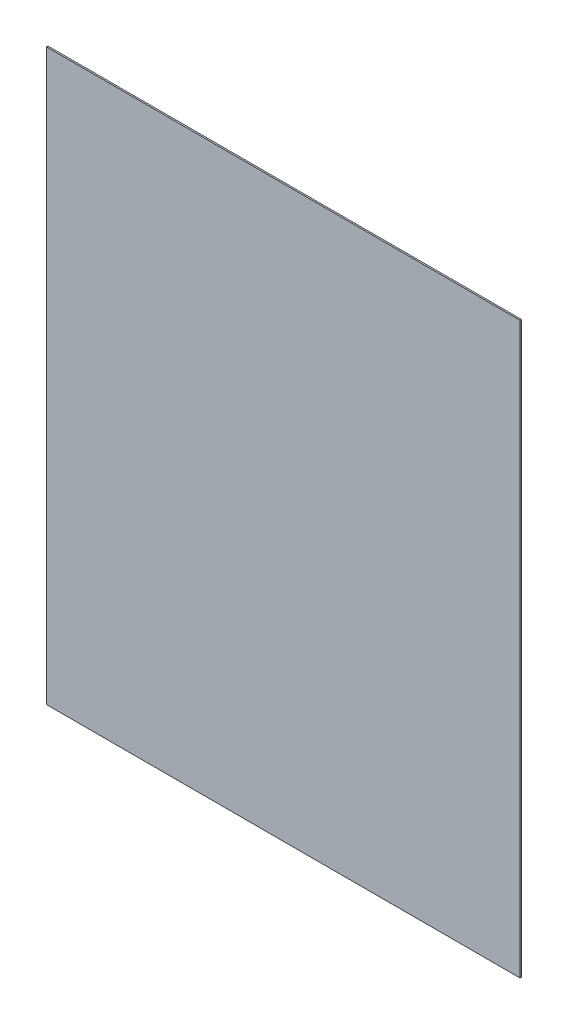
SolidWorks part; units mm, degrees
ref_plane "Plan de face" through (0, 0, 0) normal (0, 0, 1) x (1, 0, 0)
ref_plane "Plan de dessus" through (0, 0, 0) normal (0, 1, 0) x (1, 0, 0)
ref_plane "Plan de droite" through (0, 0, 0) normal (1, 0, 0) x (0, 0, -1)
sketch "Model" plane through (0, 0, 0) normal (0, 0, 1) x (1, 0, 0)
  line L0 (1032.3846, 654.3047) -> (822.3846, 654.3047)
  line L1 (822.3846, 654.3047) -> (822.3846, 464.3047)
  line L2 (822.3846, 464.3047) -> (1032.3846, 464.3047)
  line L3 (1032.3846, 464.3047) -> (1032.3846, 654.3047)
  line L4 (1302.0636, 362.1494) -> (1143.0636, 362.1494)
  line L5 (1143.0636, 362.1494) -> (1143.0636, 247.1494)
  line L6 (1143.0636, 247.1494) -> (1302.0636, 247.1494)
  line L7 (1302.0636, 247.1494) -> (1302.0636, 362.1494)
  line L8 (1290.7747, 654.3047) -> (1131.7747, 654.3047)
  line L9 (1131.7747, 654.3047) -> (1131.7747, 464.3047)
  line L10 (1131.7747, 464.3047) -> (1290.7747, 464.3047)
  line L11 (1290.7747, 464.3047) -> (1290.7747, 654.3047)
  line L12 (1023.1433, 413.8035) -> (813.1433, 413.8035)
  line L13 (813.1433, 413.8035) -> (813.1433, 211.8035)
  line L14 (813.1433, 211.8035) -> (1023.1433, 211.8035)
  line L15 (1023.1433, 211.8035) -> (1023.1433, 413.8035)
extrude "Boss.-Extru.1" add sketch "Model" along normal blind 0.5 contours L10 L11 L8 L9
sketch "Esquisse1" plane through (0, 0, 0.5) normal (0, 0, 1) x (1, 0, 0)
  line L0 (1131.7747, 654.3047) -> (1131.7747, 464.3047) construction
  line L1 (1119.2496, 659.7026) -> (1132.7747, 659.7026)
  line L2 (1119.2496, 659.7026) -> (1119.2496, 458.6467)
  line L3 (1119.2496, 458.6467) -> (1132.7747, 458.6467)
  line L4 (1132.7747, 659.7026) -> (1132.7747, 458.6467)
  dimension "D1" = 1
extrude "Enlèv. mat.-Extru.1" cut sketch "Esquisse1" against normal through all
